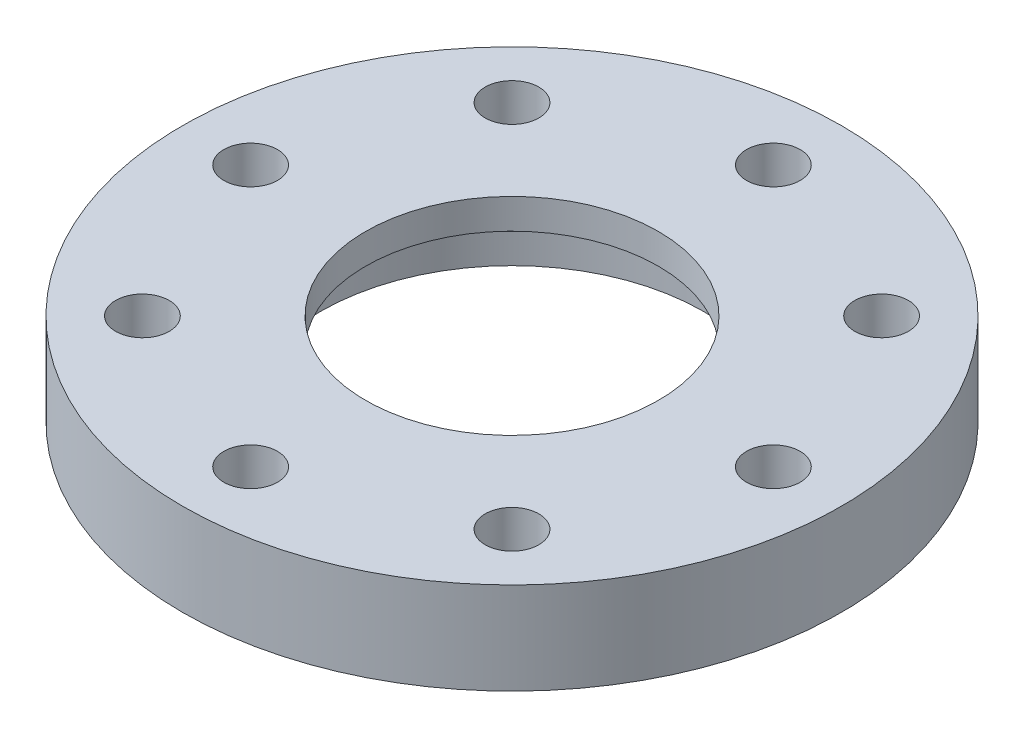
SolidWorks part; units mm, degrees
ref_plane "Alzado" through (0, 0, 0) normal (0, 0, 1) x (1, 0, 0)
ref_plane "Planta" through (0, 0, 0) normal (0, 1, 0) x (1, 0, 0)
ref_plane "Vista lateral" through (0, 0, 0) normal (1, 0, 0) x (0, 0, -1)
sketch "Croquis3" plane through (0, 0, 0) normal (0, 0, 1) x (1, 0, 0)
  line L0 (-43, 37.6835) -> (-19.1, 37.6835)
  line L1 (-19.1, 37.6835) -> (-19.1, 33.7547)
  line L2 (-19.1, 33.7547) -> (-25, 29.6235)
  line L3 (-25, 29.6235) -> (-25, 25.6835)
  line L4 (-25, 25.6835) -> (-43, 25.6835)
  line L5 (-43, 25.6835) -> (-43, 37.6835)
  line L6 (0, 0) -> (0, 37.6835) construction
  dimension "D1" = 19.1
  dimension "D2" = 25
  dimension "D3" = 12
  dimension "D4" = 43
  dimension "D5" = 125
  dimension "D6" = 3.94
revolve "Revolución1" add sketch "Croquis3" angle 360 about L6
sketch "Croquis4" plane through (0, 37.6835, 0) normal (0, 1, 0) x (1, 0, 0)
  circle A0 centre (0, 34.1) radius 3.5
  dimension "D1" = 7
  dimension "D2" = 34.1
extrude "Cortar-Extruir1" cut sketch "Croquis4" against normal through all
pattern_circular "MatrizC1" count 8 over 360 about axis through (0, 0, 0) along (0, 1, 0) of "Cortar-Extruir1"
